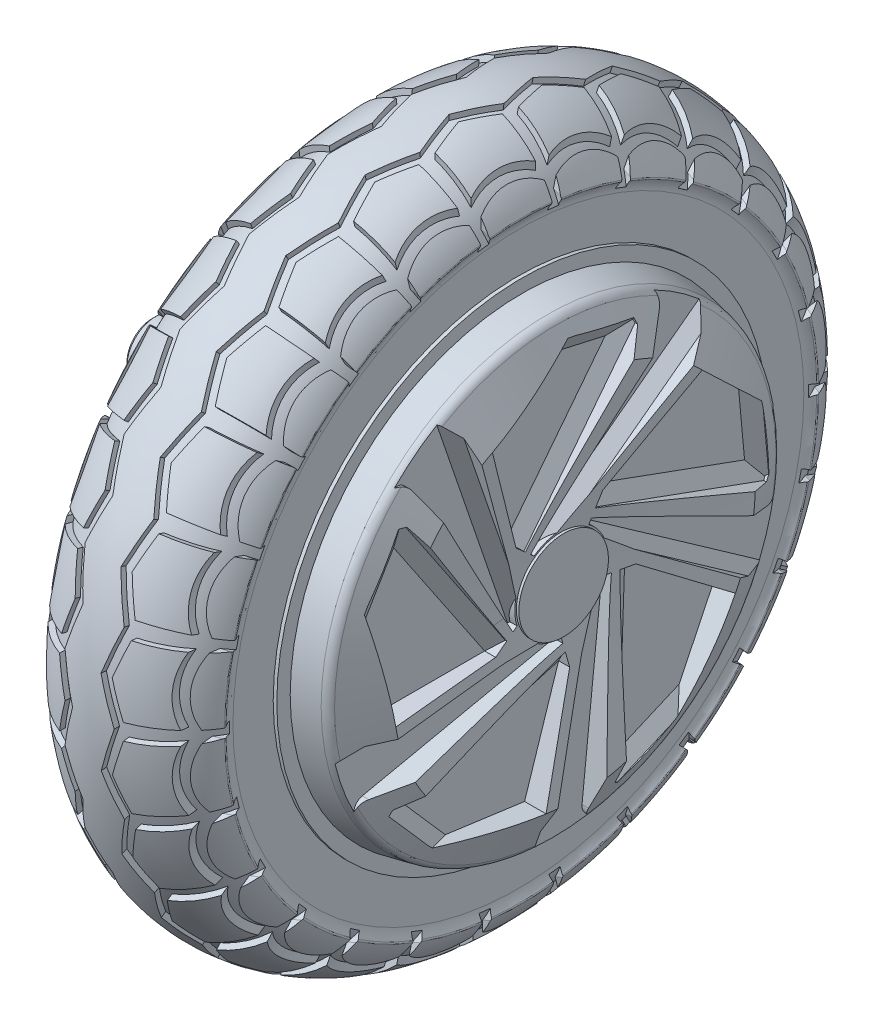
SolidWorks part; units mm, degrees
ref_plane "Front Plane" through (0, 0, 0) normal (0, 0, 1) x (1, 0, 0)
ref_plane "Top Plane" through (0, 0, 0) normal (0, 1, 0) x (1, 0, 0)
ref_plane "Right Plane" through (0, 0, 0) normal (1, 0, 0) x (0, 0, -1)
imported_body "Imported3"
sketch "Sketch1" plane through (-46.6, 0, 0) normal (-1, 0, 0) x (0, 0, 1)
  circle A0 centre (0, 0) radius 8
extrude "Boss-Extrude1" add sketch "Sketch1" along normal blind 4.4
ref_plane "Plane1" through (0, 0, 0) normal (0, 0, -1) x (-1, 0, 0)
sketch "Sketch2" plane through (0, 0, 0) normal (0, 0, -1) x (-1, 0, 0)
  line L0 (-64, 12.5) -> (-64, 0)
  line L1 (-64, 0) -> (-62.0829, 0)
  line L2 (-62.0829, 0) -> (-63.3, 12.5)
  line L3 (-63.3, 12.5) -> (-64, 12.5)
  line L4 (-64, 0) -> (-62.0829, 0) construction
revolve "Revolve1" add sketch "Sketch2" angle 360 about L4
hole_wizard "Ø7.5 (7.5) Diameter Hole1" positions "Sketch4" profile "Sketch3" hole size "Ø7.5" standard "ANSI Metric"
sketch "Sketch4" plane through (-51, 0, 0) normal (-1, 0, 0) x (0, 0, 1)
  point P0 (0, 0)
sketch "Sketch3" plane through (-51, 0, 0) normal (0, 1, 0) x (0, 0, 1)
  line L0 (0, 0) -> (0, 50)
  line L1 (0, 50) -> (3.75, 50)
  line L2 (3.75, 50) -> (3.75, 0)
  line L5 (3.75, 0) -> (0, 0)
  line L10 (0, 50) -> (-3.75, 50) construction
  line L11 (0, -6.35) -> (0, 107.95) construction
  dimension "Hole Dia." = 7.5
  dimension "Hole Depth" = 50
  dimension "Drill Angle" = 180
chamfer "Chamfer1" distance 1 angle 45 1 edges at (-51, 0, 8)
fillet "Fillet1" radius 0.5 52 edges at (52.35, -9.7566, -82.1728) (52.35, 29.5486, -77.2945) (4.85, 38.4558, -73.2715) (52.35, 61.7935, 55.0374) (52.35, 47.1878, -67.977) (4.85, -54.8734, 61.9393) (52.35, 62.0845, -54.709) (52.35, 10.1922, -82.1199) (52.35, 80.3977, -19.5903) (52.35, 80.2926, 20.0163) (52.35, 73.3732, -38.2614) (4.85, 54.8734, -61.9393) (52.35, 82.7497, 0.2194) (4.85, 19.8034, -80.3454) (52.35, 73.1693, 38.65) (4.85, 68.1019, -47.0074) (52.35, 46.8266, 68.2263) (52.35, 29.1383, 77.4501) (4.85, -68.1019, 47.0074) (4.85, 0, -82.75) (4.85, -19.8034, 80.3454) (4.85, 77.3726, -29.3436) (4.85, -38.4558, 73.2715) (4.85, -19.8034, -80.3454) (52.35, -29.1383, -77.4501) (4.85, 82.1467, -9.9744) (52.35, -46.8266, -68.2263) (4.85, -38.4558, -73.2715) (52.35, -61.7935, -55.0374) (4.85, 82.1467, 9.9744) (52.35, -73.1693, -38.65) (4.85, -54.8734, -61.9393) (52.35, -80.2926, -20.0163) (4.85, 77.3726, 29.3436) (52.35, -82.7497, -0.2194) (4.85, -68.1019, -47.0074) (52.35, -80.3977, 19.5903) (4.85, 68.1019, 47.0074) (52.35, -73.3732, 38.2614) (4.85, -77.3726, -29.3436) (52.35, -62.0845, 54.709) (4.85, 54.8734, 61.9393) (52.35, -47.1878, 67.977) (4.85, -82.1467, -9.9744) (52.35, -29.5486, 77.2945) (4.85, 38.4558, 73.2715) (52.35, -10.1922, 82.1199) (4.85, 19.8034, 80.3454) (52.35, 9.7566, 82.1728) (4.85, -77.3726, 29.3436) (4.85, 0, 82.75) (4.85, -82.1467, 9.9744)
